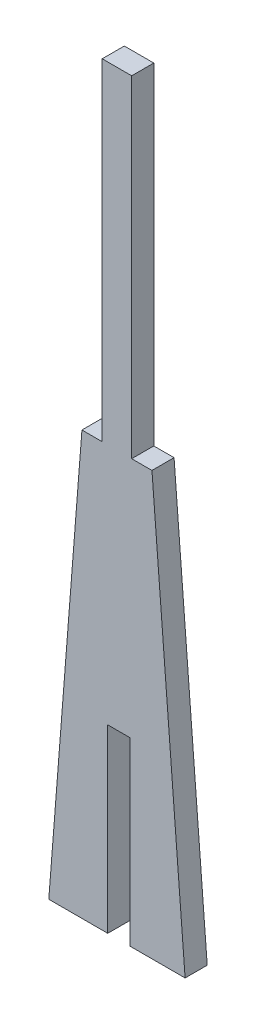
SolidWorks part; units mm, degrees
ref_plane "Alzado" through (0, 0, 0) normal (0, 0, 1) x (1, 0, 0)
ref_plane "Planta" through (0, 0, 0) normal (0, 1, 0) x (1, 0, 0)
ref_plane "Vista lateral" through (0, 0, 0) normal (1, 0, 0) x (0, 0, -1)
sketch "Sketch1" plane through (0, 0, 0) normal (0, 0, 1) x (1, 0, 0)
  line L0 (-9.25, 0) -> (-1.25, 0)
  line L1 (1.75, 0) -> (9.25, 0)
  line L2 (-4.75, 57.4) -> (4.75, 57.4)
  line L3 (-4.75, 57.4) -> (-9.25, 0)
  line L4 (4.75, 57.4) -> (9.25, 0)
  line L5 (-1.25, 24.5) -> (1.75, 24.5)
  line L6 (-1.25, 24.5) -> (-1.25, 0)
  line L7 (1.75, 24.5) -> (1.75, 0)
  line L8 (-2, 102.4) -> (2, 102.4)
  line L9 (-2, 102.4) -> (-2, 57.4)
  line L10 (2, 102.4) -> (2, 57.4)
  point P4 (0, 0)
  point P10 (0, 57.4)
  point P12 (0.25, 24.5)
  point P17 (0, 102.4)
  dimension "D1" = 18.5
  dimension "D2" = 24.5
  dimension "D3" = 9.5
  dimension "D4" = 3
  dimension "D5" = 4.483
  dimension "D6" = 25.6223
  dimension "D7" = 57.4
  dimension "D8" = 45
  dimension "D9" = 4
  dimension "D10" = 2.75
extrude "Boss-Extrude1" add sketch "Sketch1" along normal blind 3 contours L5 L7 L0 L4 L2 L3 L6 | L10 L8 L9 L2
